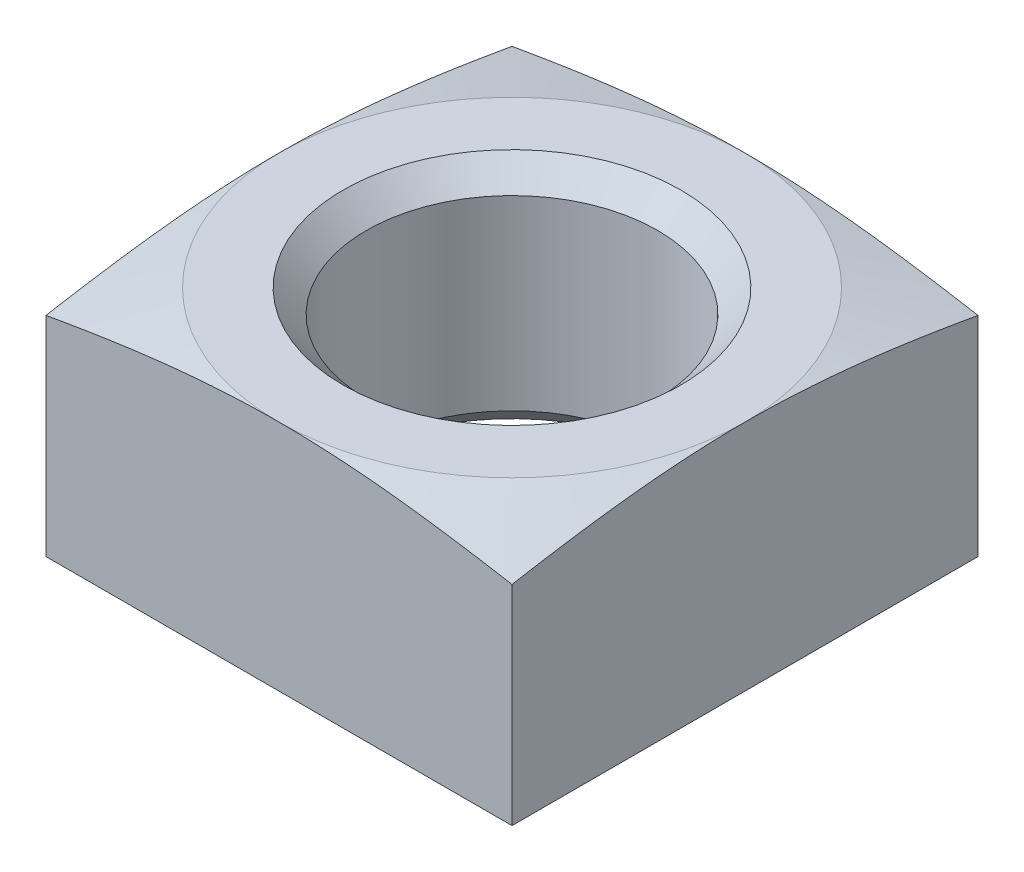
SolidWorks part; units mm, degrees
ref_plane "Front Plane" through (0, 0, 0) normal (0, 0, 1) x (1, 0, 0)
ref_plane "Top Plane" through (0, 0, 0) normal (0, 1, 0) x (1, 0, 0)
ref_plane "Right Plane" through (0, 0, 0) normal (1, 0, 0) x (0, 0, -1)
sketch "Sketch6" plane through (0, 0, 0) normal (1, 0, 0) x (0, 0, -1)
  line L0 (0, 59.8384) -> (0, -60.7908) construction
sketch "Sketch8" plane through (0, 0, 0) normal (1, 0, 0) x (0, 0, -1)
  line L1 (4, 2) -> (-4, 2)
  line L2 (4, 2) -> (4, -2)
  line L3 (4, -2) -> (-4, -2)
  line L4 (-4, 2) -> (-4, -2)
  line L5 (4, 2) -> (-4, -2) construction
  line L6 (4, -2) -> (-4, 2) construction
  point P0 (0, 0)
  dimension "D1" = 4
  dimension "D2" = 8
extrude "Boss-Extrude2" add sketch "Sketch8" along normal mid plane 8
sketch "Sketch10" plane through (0, 0, 0) normal (1, 0, 0) x (0, 0, -1)
  line L0 (-4, 2) -> (-6, 2)
  line L1 (-6, 2) -> (-6, 1.5)
  line L2 (-6, 1.5) -> (-4, 2)
  point P0 (-4, 2)
  point P6 (-4, 2)
  dimension "D1" = 0.5
  dimension "D2" = 2
revolve "Cut-Revolve1" cut sketch "Sketch10" angle 360 about L0
sketch "Sketch11" plane through (0, 2, 0) normal (0, 1, 0) x (1, 0, 0)
  circle A0 centre (0, 0) radius 2.5
  dimension "D1" = 5
extrude "Cut-Extrude1" cut sketch "Sketch11" against normal up to surface (4 mm away)
chamfer "Chamfer1" distance 0.4 angle 45 2 edges at (0, 2, 2.5) (0, -2, 2.5)
